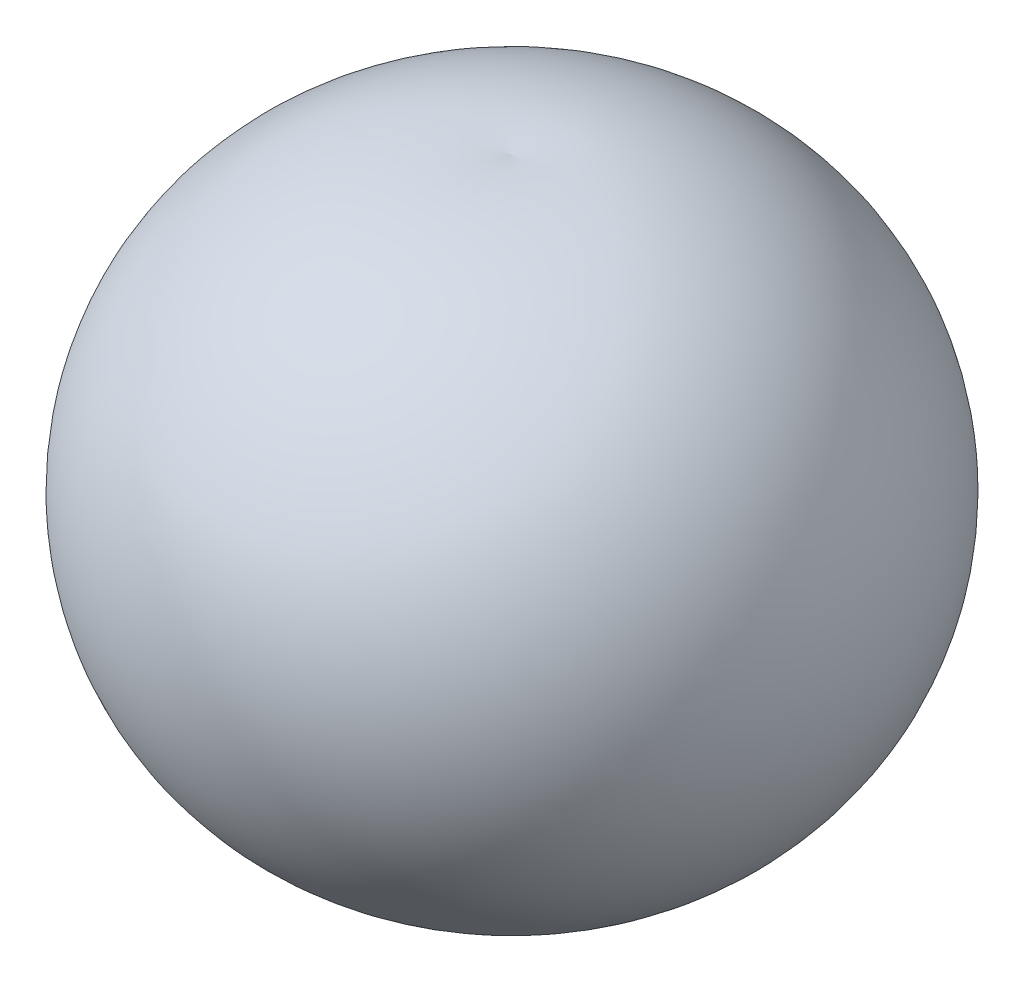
SolidWorks part; units mm, degrees
ref_plane "前视基准面" through (0, 0, 0) normal (0, 0, 1) x (1, 0, 0)
ref_plane "上视基准面" through (0, 0, 0) normal (0, 1, 0) x (1, 0, 0)
ref_plane "右视基准面" through (0, 0, 0) normal (1, 0, 0) x (0, 0, -1)
sketch "草图1" plane through (0, 0, 0) normal (0, 0, 1) x (1, 0, 0)
  line L0 (0, -1326.4585) -> (0, 2857.3611) construction
  line L1 (0, 2216.4585) -> (0, 1304.4502)
  line L2 (0, 77.2501) -> (0, -1131.0608)
  arc A1 (971.2468, -1172.4875) -> (0, 2216.4585) centre (217, 445) ccw
  arc A2 (0, -1131.0608) -> (971.2468, -1172.4875) centre (525.5113, -216.6047) ccw
  arc A3 (0, 77.2501) -> (459.3085, 796.5901) centre (217, 445) ccw
  arc A4 (459.3085, 796.5901) -> (0, 1304.4502) centre (-510.2221, 381.3763) ccw
  dimension "D6" = 2109.4
  dimension "D2" = 445
  dimension "D3" = 217
  dimension "D7" = 730
  dimension "D10" = 730
revolve "旋转1" add sketch "草图1" angle 360 about L0
